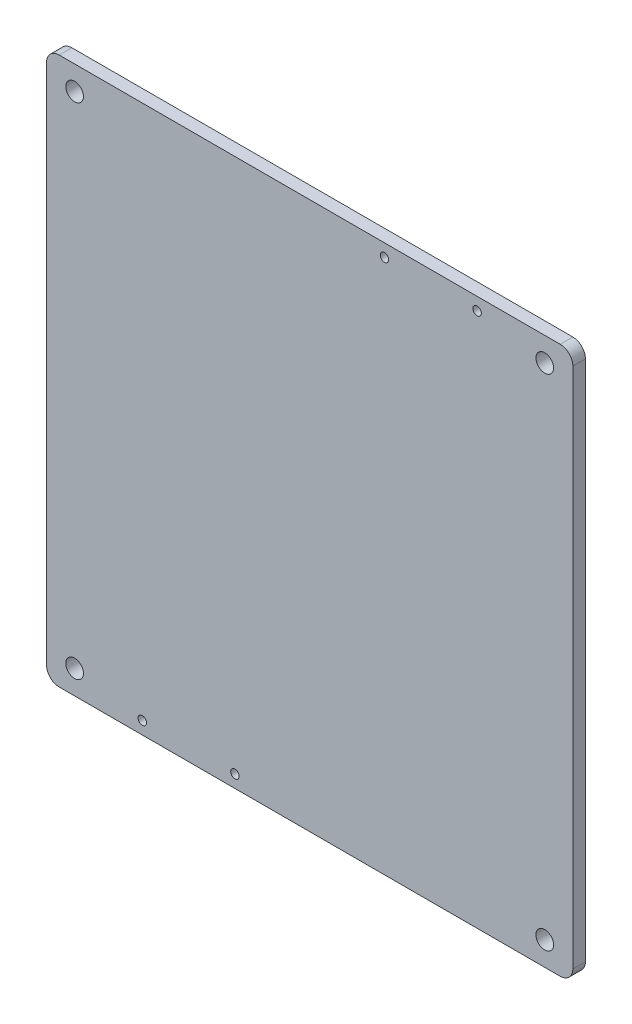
SolidWorks part; units mm, degrees
ref_plane "Front Plane" through (0, 0, 0) normal (0, 0, 1) x (1, 0, 0)
ref_plane "Top Plane" through (0, 0, 0) normal (0, 1, 0) x (1, 0, 0)
ref_plane "Right Plane" through (0, 0, 0) normal (1, 0, 0) x (0, 0, -1)
sketch "Sketch1" plane through (0, 0, 0) normal (0, 0, 1) x (1, 0, 0)
  line L1 (-62.5, -65) -> (62.5, -65)
  line L2 (-62.5, -65) -> (-62.5, 65)
  line L3 (-62.5, 65) -> (62.5, 65)
  line L4 (62.5, -65) -> (62.5, 65)
  line L5 (-62.5, -65) -> (62.5, 65) construction
  line L6 (-62.5, 65) -> (62.5, -65) construction
  point P0 (0, 0)
  dimension "D1" = 125
  dimension "D2" = 130
extrude "Boss-Extrude1" add sketch "Sketch1" along normal blind 3
fillet "Fillet1" radius 3 4 edges at (62.5, -65, 1.5) (-62.5, -65, 1.5) (-62.5, 65, 1.5) (62.5, 65, 1.5)
sketch "Sketch2" plane through (0, 0, 0) normal (0, 0, -1) x (-1, 0, 0)
  line L1 (-55.835, -59.325) -> (55.835, -59.325) construction
  line L2 (-55.835, -59.325) -> (-55.835, 59.325) construction
  line L3 (-55.835, 59.325) -> (55.835, 59.325) construction
  line L4 (55.835, -59.325) -> (55.835, 59.325) construction
  line L5 (-55.835, -59.325) -> (55.835, 59.325) construction
  line L6 (-55.835, 59.325) -> (55.835, -59.325) construction
  circle A0 centre (-55.835, 59.325) radius 2.1
  circle A1 centre (55.835, 59.325) radius 2.1
  circle A2 centre (-55.835, -59.325) radius 2.1
  circle A3 centre (55.835, -59.325) radius 2.1
  point P0 (0, 0)
  dimension "D1" = 118.65
  dimension "D2" = 111.67
extrude "Cut-Extrude1" cut sketch "Sketch2" against normal up to surface (3 mm away)
sketch "Sketch3" plane through (0, 0, 0) normal (0, 0, -1) x (-1, 0, 0)
  line L0 (-62.5, 62) -> (62.5, 62) construction
  line L1 (-62.5, -62) -> (-62.5, 62) construction
  line L2 (62.5, 62) -> (62.5, -62) construction
  line L3 (-59.5, 65) -> (59.5, 65) construction
  line L4 (-62.5, -62) -> (62.5, -62) construction
  line L5 (59.5, -65) -> (-59.5, -65) construction
  circle A0 centre (-39.76, 62) radius 1
  circle A1 centre (-17.76, 62) radius 1
  circle A2 centre (39.76, -62) radius 1
  circle A3 centre (17.76, -62) radius 1
  dimension "D2" = 2
  dimension "D4" = 22
  dimension "D5" = 2
  dimension "D7" = 2
  dimension "D9" = 2
  dimension "D1" = 3
  dimension "D3" = 22.74
  dimension "D6" = 3
  dimension "D8" = 22.74
  dimension "D10" = 22
extrude "Cut-Extrude2" cut sketch "Sketch3" against normal up to surface (3 mm away)
